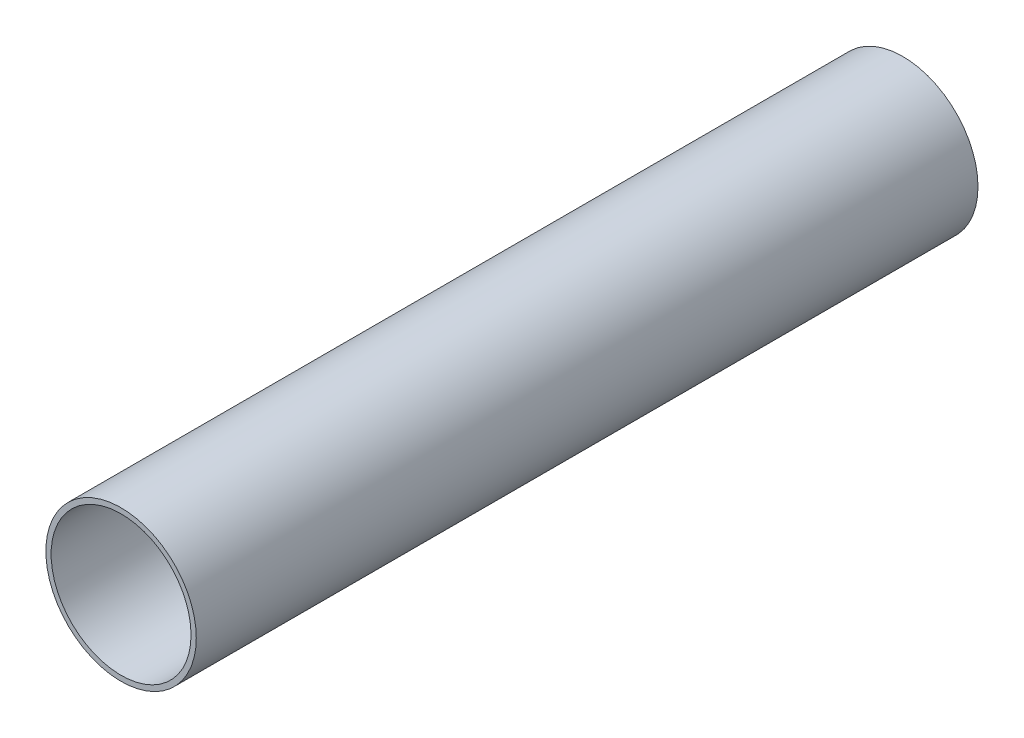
SolidWorks part; units mm, degrees
ref_plane "Front Plane" through (0, 0, 0) normal (0, 0, 1) x (1, 0, 0)
ref_plane "Top Plane" through (0, 0, 0) normal (0, 1, 0) x (1, 0, 0)
ref_plane "Right Plane" through (0, 0, 0) normal (1, 0, 0) x (0, 0, -1)
sketch "Sketch1" plane through (0, 0, 0) normal (0, 0, 1) x (1, 0, 0)
  circle A0 centre (0, 0) radius 27.051
  circle A1 centre (0, 0) radius 29.083
extrude "Extrude3" add sketch "Sketch1" along normal blind 302.26
